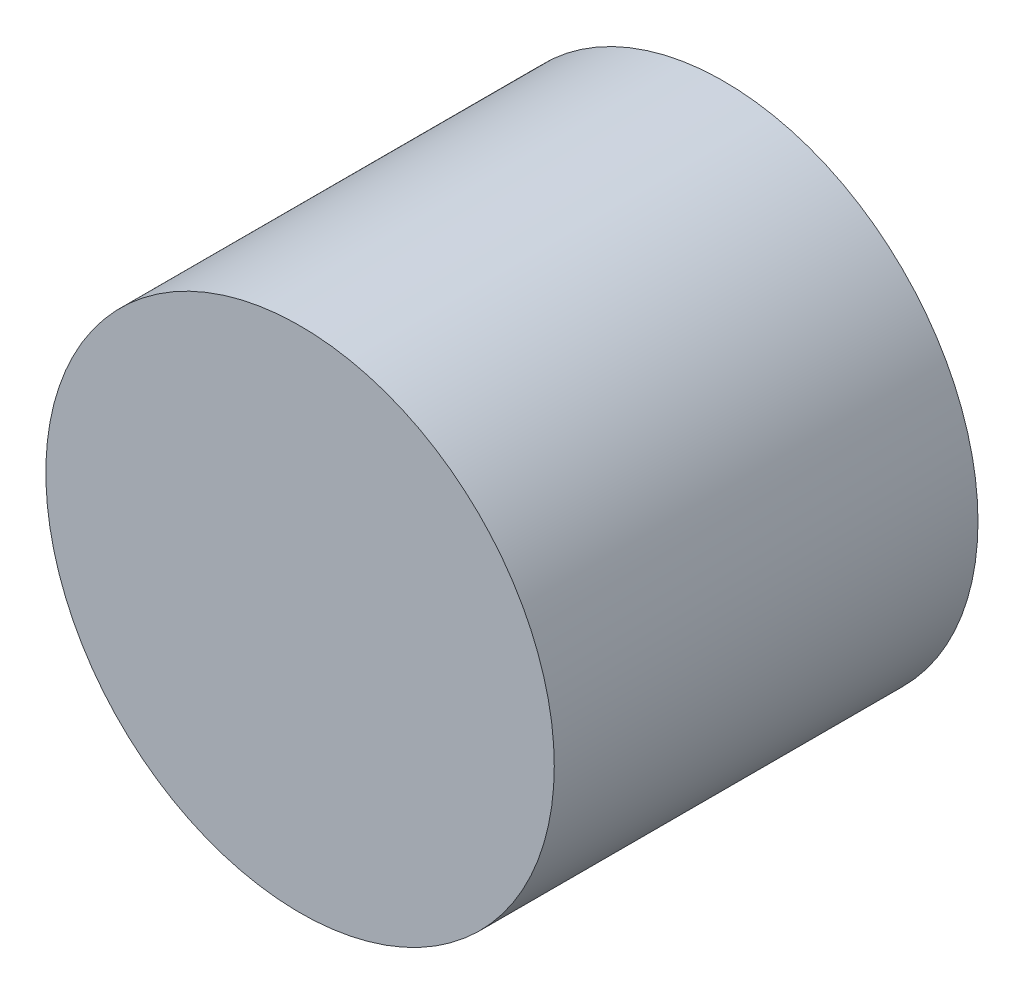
SolidWorks part; units mm, degrees
ref_plane "Alzado" through (0, 0, 0) normal (0, 0, 1) x (1, 0, 0)
ref_plane "Planta" through (0, 0, 0) normal (0, 1, 0) x (1, 0, 0)
ref_plane "Vista lateral" through (0, 0, 0) normal (1, 0, 0) x (0, 0, -1)
sketch "Croquis1" plane through (0, 0, 0) normal (0, 0, 1) x (1, 0, 0)
  circle A0 centre (0, 0) radius 60
  dimension "D1" = 120
extrude "Saliente-Extruir1" add sketch "Croquis1" along normal blind 100
